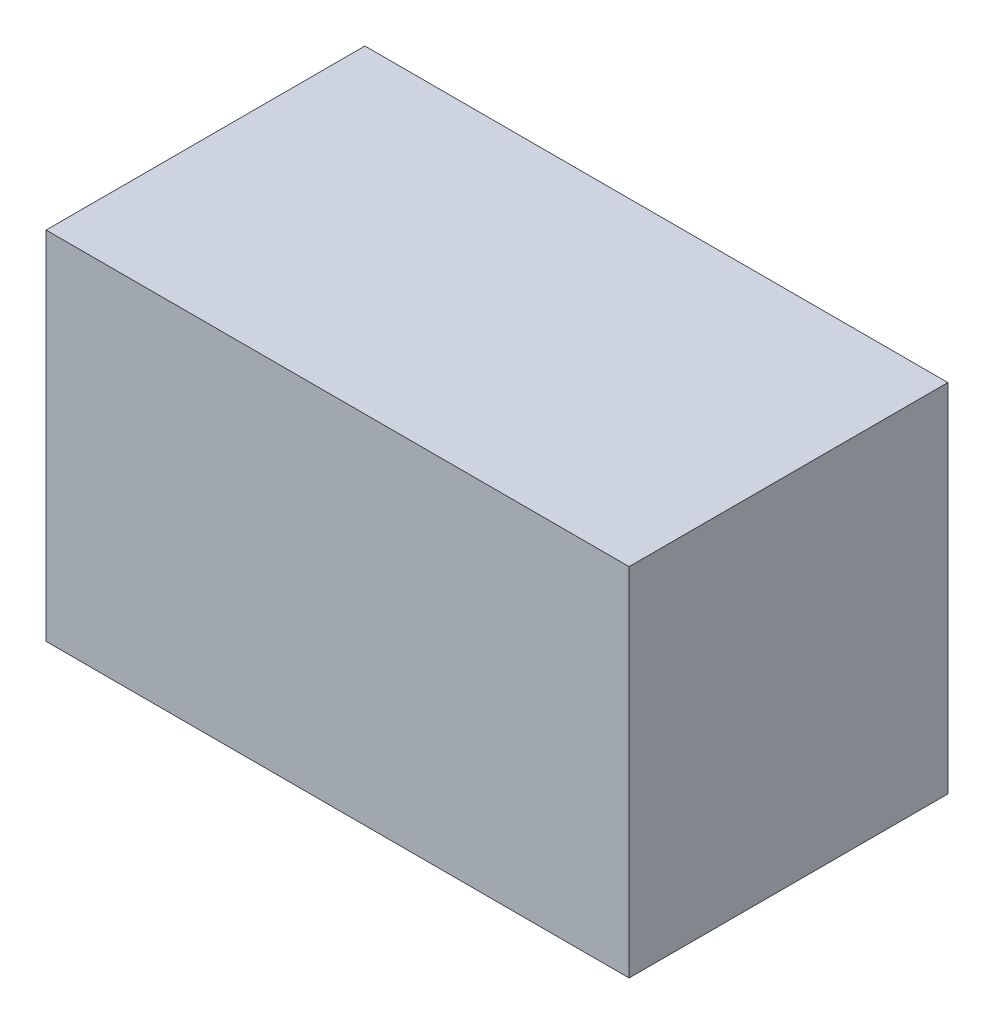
SolidWorks part; units mm, degrees
ref_plane "Front Plane" through (0, 0, 0) normal (0, 0, 1) x (1, 0, 0)
ref_plane "Top Plane" through (0, 0, 0) normal (0, 1, 0) x (1, 0, 0)
ref_plane "Right Plane" through (0, 0, 0) normal (1, 0, 0) x (0, 0, -1)
sketch "GENERAL" plane through (0, 0, 0) normal (0, 0, 1) x (1, 0, 0)
  line L12 (-2.286, -1.397) -> (2.286, -1.397)
  line L13 (2.286, -1.397) -> (2.286, 1.397)
  line L14 (2.286, 1.397) -> (-2.286, 1.397)
  line L15 (-2.286, 1.397) -> (-2.286, -1.397)
extrude "Boss-Extrude1" add sketch "GENERAL" along normal blind 2.5
